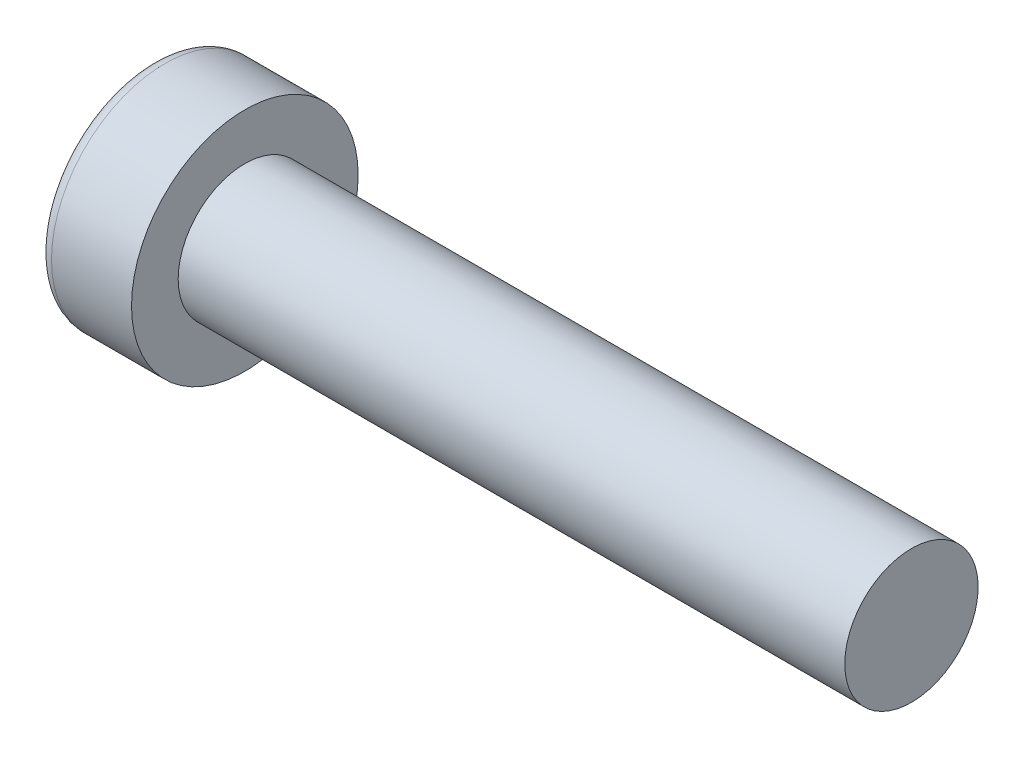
SolidWorks part; units mm, degrees
ref_plane "Ebene vorne" through (0, 0, 0) normal (0, 0, 1) x (1, 0, 0)
ref_plane "Ebene oben" through (0, 0, 0) normal (0, 1, 0) x (1, 0, 0)
ref_plane "Ebene rechts" through (0, 0, 0) normal (1, 0, 0) x (0, 0, -1)
sketch "Skizze1" plane through (0, 0, 0) normal (0, 0, 1) x (1, 0, 0)
  line L0 (-65.0118, 0) -> (64.6036, 0) construction
  line L1 (-28.5, 0) -> (-28.5, 4.25)
  line L2 (-28.5, 4.25) -> (-25, 4.25)
  line L3 (-25, 4.25) -> (-25, 2.5)
  line L4 (-25, 2.5) -> (0, 2.5)
  line L5 (0, 2.5) -> (0, 0)
  line L6 (0, 0) -> (-28.5, 0)
  dimension "D1" = 5
  dimension "D2" = 25
  dimension "D3" = 8.5
  dimension "D4" = 3.5
revolve "Rotation1" add sketch "Skizze1" angle 360 about L0
fillet "Verrundung1" radius 0.5 1 edges at (-28.5, 0, 4.25)
sketch "Skizze2" plane through (-28.5, 0, 0) normal (-1, 0, 0) x (0, 0, 1)
  line L1 (2, 1.1547) -> (0, 2.3094)
  line L2 (0, 2.3094) -> (-2, 1.1547)
  line L3 (-2, 1.1547) -> (-2, -1.1547)
  line L4 (-2, -1.1547) -> (0, -2.3094)
  line L5 (0, -2.3094) -> (2, -1.1547)
  line L6 (2, -1.1547) -> (2, 1.1547)
  circle A0 centre (0, 0) radius 2 construction
  dimension "D1" = 4
extrude "Schnitt-Linear austragen1" cut sketch "Skizze2" against normal blind 3
